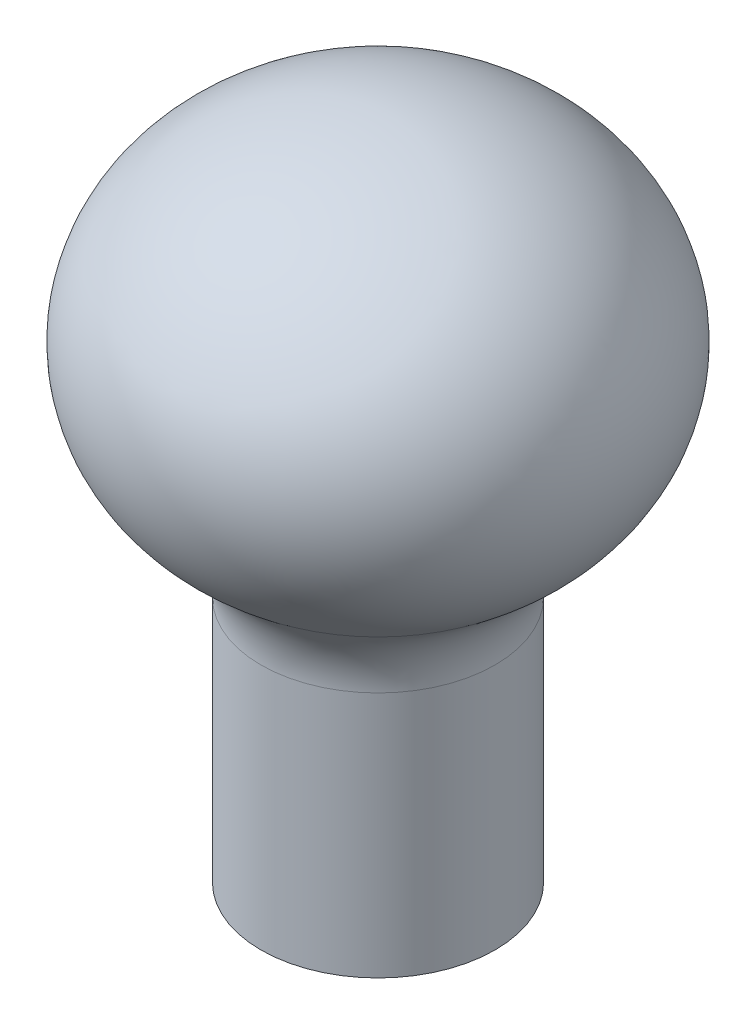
SolidWorks part; units mm, degrees
ref_plane "Front Plane" through (0, 0, 0) normal (0, 0, 1) x (1, 0, 0)
ref_plane "Top Plane" through (0, 0, 0) normal (0, 1, 0) x (1, 0, 0)
ref_plane "Right Plane" through (0, 0, 0) normal (1, 0, 0) x (0, 0, -1)
sketch "Sketch1" plane through (0, 0, 0) normal (0, 0, 1) x (1, 0, 0)
  line L0 (0, -55) -> (0, 55) construction
  line L1 (7.5, 0) -> (7.5, 19.1747)
  line L2 (55, 0) -> (-55, 0) construction
  line L4 (0, 0) -> (7.5, 0)
  line L5 (0, 42.5) -> (0, 0)
  line L6 (0, 0) -> (0, 54.6084) construction
  ellipse E0 centre (0, 30) end of major axis (-15, 30) minor radius 12.5 (7.5, 19.1747) -> (0, 42.5) ccw
  dimension "D3" = 7.5
  dimension "D1" = 15
  dimension "D2" = 25
  dimension "D4" = 30
revolve "Revolve1" add sketch "Sketch1" angle 360 about L6
fillet "Fillet1" radius 6 1 edges at (0, 19.1747, -7.5)
